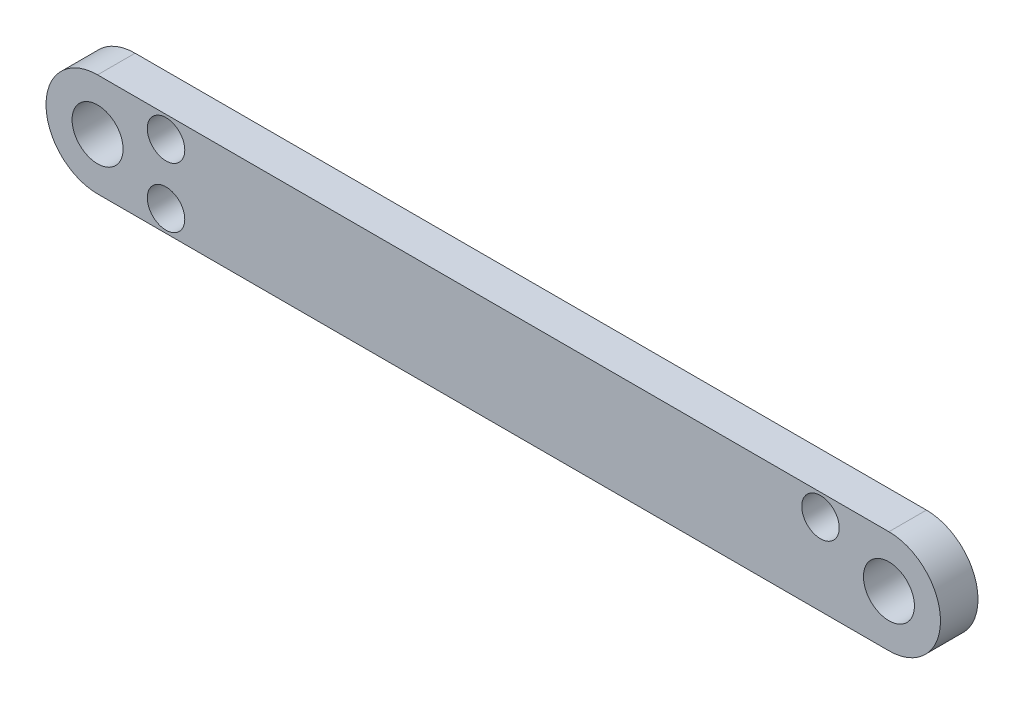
SolidWorks part; units mm, degrees
ref_plane "Front Plane" through (0, 0, 0) normal (0, 0, 1) x (1, 0, 0)
ref_plane "Top Plane" through (0, 0, 0) normal (0, 1, 0) x (1, 0, 0)
ref_plane "Right Plane" through (0, 0, 0) normal (1, 0, 0) x (0, 0, -1)
sketch "Sketch1" plane through (0, 0, 0) normal (0, 0, 1) x (1, 0, 0)
  line L0 (-26.797, 0) -> (26.797, 0) construction
  line L1 (-26.797, 3.4925) -> (26.797, 3.4925)
  line L2 (-26.797, -3.4925) -> (26.797, -3.4925)
  arc A0 (-26.797, 3.4925) -> (-26.797, -3.4925) centre (-26.797, 0) ccw
  arc A1 (26.797, -3.4925) -> (26.797, 3.4925) centre (26.797, 0) ccw
  circle A2 centre (26.797, 0) radius 3.4925 construction
  point P2 (0, 0)
extrude "Boss-Extrude1" add sketch "Sketch1" along normal blind 2.54
hole_wizard "#4 Clearance Hole1" positions "Sketch3" profile "Sketch2" hole size "#4" standard "ANSI Inch"
sketch "Sketch3" plane through (0, 0, 2.54) normal (0, 0, 1) x (1, 0, 0)
  point P0 (-26.797, 0)
  point P3 (26.797, 0)
sketch "Sketch2" plane through (-26.797, 0, 2.54) normal (1, 0, 0) x (0, -1, 0)
  line L0 (0, 0) -> (0, 7.3878)
  line L1 (0, 7.3878) -> (1.7272, 6.35)
  line L2 (1.7272, 6.35) -> (1.7272, 0)
  line L5 (1.7272, 0) -> (0, 0)
  line L10 (0, 7.3878) -> (-1.7272, 6.35) construction
  line L11 (0, -6.35) -> (0, 107.95) construction
  dimension "Hole Dia." = 3.4544
  dimension "Hole Depth" = 6.35
  dimension "Drill Angle" = 118
sketch "Sketch4" plane through (0, 0, 2.54) normal (0, 0, 1) x (1, 0, 0)
  line L0 (22.5425, 1.651) -> (21.7805, 2.413) construction
  line L1 (-21.7805, 1.651) -> (-22.5425, 2.413) construction
  circle A0 centre (22.1615, 2.032) radius 1.27
  circle A1 centre (-22.1615, -2.032) radius 1.27
  circle A2 centre (-22.1615, 2.032) radius 1.27
  dimension "D1" = 2.54
extrude "Cut-Extrude1" cut sketch "Sketch4" against normal through all
